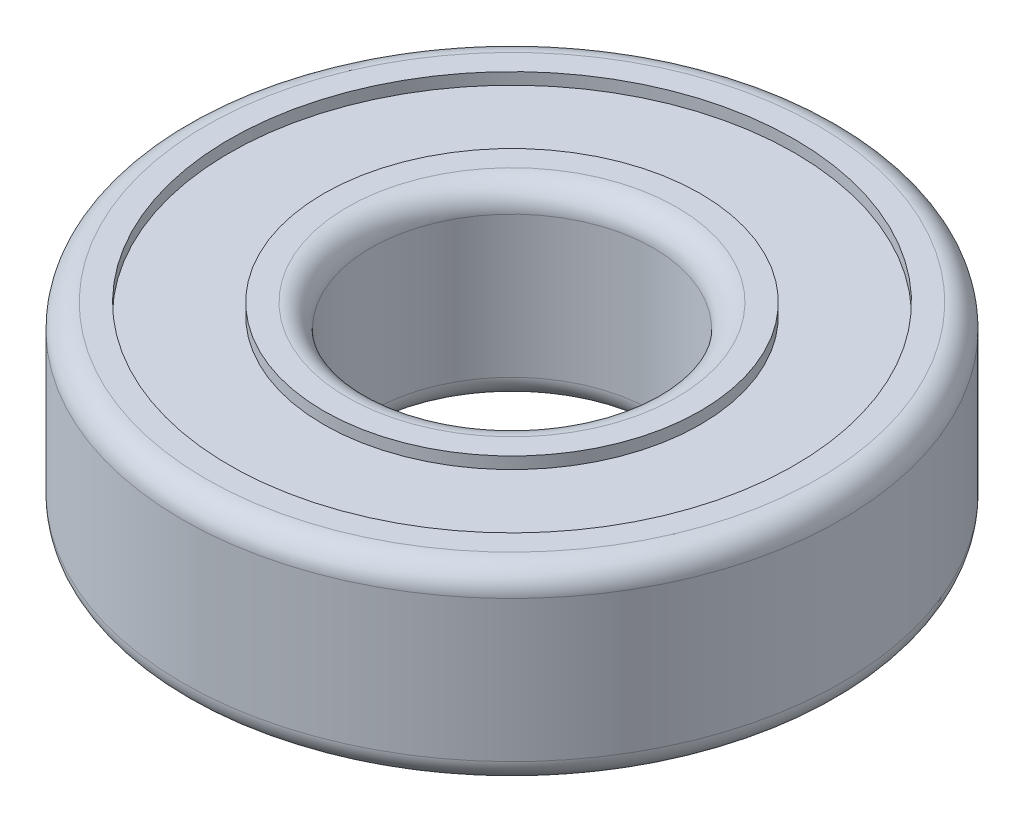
SolidWorks part; units mm, degrees
ref_plane "Спереди" through (0, 0, 0) normal (0, 0, 1) x (1, 0, 0)
ref_plane "Сверху" through (0, 0, 0) normal (0, 1, 0) x (1, 0, 0)
ref_plane "Справа" through (0, 0, 0) normal (1, 0, 0) x (0, 0, -1)
sketch "Эскиз1" plane through (0, 0, 0) normal (0, 0, 1) x (1, 0, 0)
  line L0 (0, 0) -> (0, 34.426) construction
  line L1 (0, 0) -> (-26.5532, 0) construction
  line L2 (-6, -3) -> (-6, 3)
  line L3 (-7, 4) -> (-8, 4)
  line L4 (-8, 4) -> (-8, 3.5)
  line L5 (-8, 3.5) -> (-12, 3.5)
  line L6 (-12, 3.5) -> (-12, 4)
  line L7 (-12, 4) -> (-13, 4)
  line L8 (-14, 3) -> (-14, -3)
  line L9 (-12, -4) -> (-13, -4)
  line L10 (-12, -3.5) -> (-12, -4)
  line L11 (-8, -3.5) -> (-12, -3.5)
  line L12 (-8, -4) -> (-8, -3.5)
  line L13 (-7, -4) -> (-8, -4)
  arc A0 (-7, -4) -> (-6, -3) centre (-7, -3) ccw
  arc A1 (-13, -4) -> (-14, -3) centre (-13, -3) cw
  arc A2 (-6, 3) -> (-7, 4) centre (-7, 3) ccw
  arc A3 (-13, 4) -> (-14, 3) centre (-13, 3) ccw
  point P13 (-14, 0)
  point P18 (-6, 0)
  point P20 (-6, -4)
  point P23 (-14, -4)
  point P26 (-6, 4)
  point P29 (-14, 4)
  dimension "D7" = 1
  dimension "D1" = 12
  dimension "D2" = 2
  dimension "D3" = 2
  dimension "D4" = 0.5
  dimension "D5" = 28
  dimension "D6" = 4
revolve "Повернуть1" add sketch "Эскиз1" angle 360 about L0
